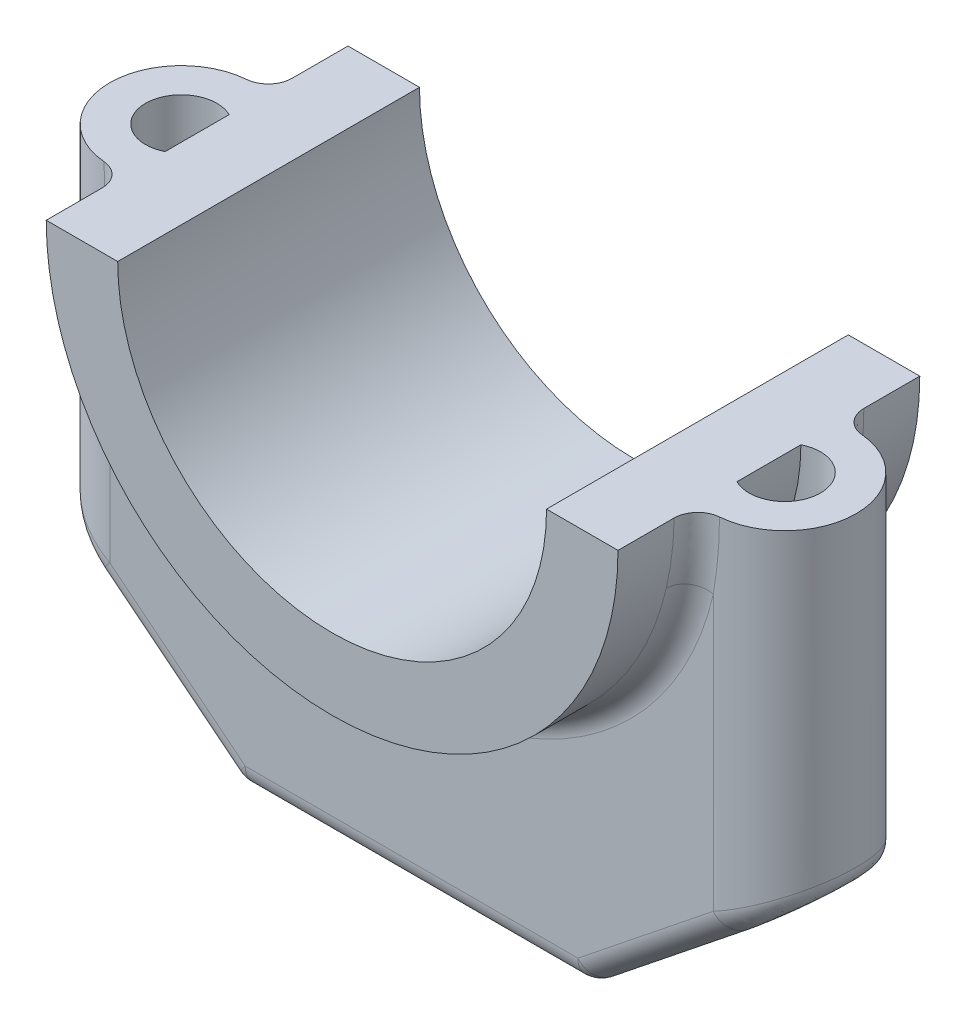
SolidWorks part; units mm, degrees
ref_plane "Front Plane" through (0, 0, 0) normal (0, 0, 1) x (1, 0, 0)
ref_plane "Top Plane" through (0, 0, 0) normal (0, 1, 0) x (1, 0, 0)
ref_plane "Right Plane" through (0, 0, 0) normal (1, 0, 0) x (0, 0, -1)
sketch "Sketch1" plane through (0, 0, 0) normal (0, 0, 1) x (1, 0, 0)
  line L0 (0, 0) -> (-36, 0)
  line L4 (36, 0) -> (0, 0)
  arc A0 (-27, 0) -> (27, 0) centre (0, 0) ccw
  arc A1 (-36, 0) -> (36, 0) centre (0, 0) ccw
  dimension "D3" = 54
  dimension "D4" = 72
extrude "Boss-Extrude1" add sketch "Sketch1" along normal mid plane 38 contours L0 A1 L4 A0
sketch "Sketch2" plane through (0, 0, 0) normal (0, 1, 0) x (1, 0, 0)
  line L0 (49.8206, 0) -> (33.5, 0) construction
  line L1 (0, 31.5619) -> (0, -30.4198) construction
  line L8 (-33.5, 0) -> (-55.4367, 0) construction
  line L9 (29, 0) -> (-29, 0) construction
  line L10 (-38, 9) -> (38, 9)
  line L11 (-38, -9) -> (38, -9)
  circle A0 centre (-38, 0) radius 4.5
  arc A1 (-38, 9) -> (-38, -9) centre (-38, 0) ccw
  circle A2 centre (38, 0) radius 4.5
  arc A3 (38, 9) -> (38, -9) centre (38, 0) cw
  dimension "D1" = 9
  dimension "D2" = 18
  dimension "D3" = 38
extrude "Boss-Extrude4" add sketch "Sketch2" against normal blind 60
sketch "Sketch4" plane through (0, 0, -9) normal (0, 0, -1) x (-1, 0, 0)
  line L1 (27, 0) -> (-27, 0)
  line L2 (27, 0) -> (-27, 0)
  arc A1 (-27, 0) -> (27, 0) centre (0, 0) ccw
  arc A2 (-27, 0) -> (27, 0) centre (0, 0) ccw
  dimension "D1" = 0
extrude "Cut-Extrude2" cut sketch "Sketch4" against normal through all both and the other way through all
sketch "Sketch5" plane through (0, 0, 9) normal (0, 0, 1) x (1, 0, 0)
  line L0 (-47, -60) -> (-47, -40)
  line L1 (-47, 0) -> (-47, -60) construction
  line L2 (-47, -40) -> (-22, -60)
  line L3 (-38, -60) -> (38, -60) construction
  line L4 (-22, -60) -> (-47, -60)
  line L5 (0, 0) -> (0, -75.1946) construction
  line L6 (22, -60) -> (47, -60)
  line L7 (47, -60) -> (47, -40)
  line L8 (47, -40) -> (22, -60)
  dimension "D1" = 25
  dimension "D2" = 20
extrude "Cut-Extrude3" cut sketch "Sketch5" against normal through all
fillet "Fillet1" radius 3 2 edges at (0, -36, 9) (0, -36, -9)
fillet "Fillet2" radius 3 10 edges at (30, -53.6, 9) (47, -40, 0) (-30, -53.6, -9) (-47, -40, 0) (22, -60, 0) (0, -60, -9) (-22, -60, 0) (0, -60, 9) (30, -53.6, -9) (-30, -53.6, 9)
